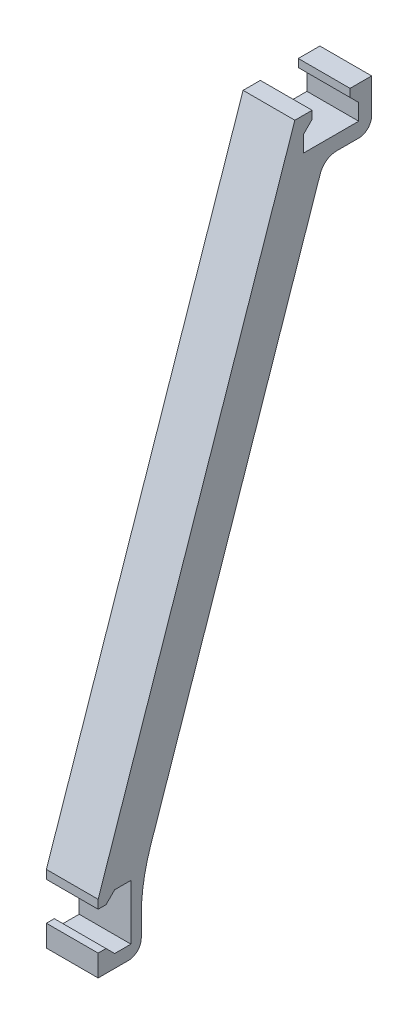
SolidWorks part; units mm, degrees
ref_plane "Plano frontal" through (0, 0, 0) normal (1, 0, 0) x (0, 1, 0)
ref_plane "Plano superior" through (0, 0, 0) normal (0, 0, 1) x (0, 1, 0)
ref_plane "Plano direito" through (0, 0, 0) normal (0, 1, 0) x (-1, 0, 0)
sketch "Esboço1" plane through (0, 0, 0) normal (1, 0, 0) x (0, 1, 0)
  line L14 (-77.8, -10) -> (-77.8, -10.9172)
  line L15 (-77.8, -10.9172) -> (-76.8, -11.9172)
  line L16 (-76.8, -11.9172) -> (-76.8, -13.8)
  line L17 (-76.8, -13.8) -> (-83.2, -13.8)
  line L18 (-83.2, -13.8) -> (-83.2, -11.9172)
  line L19 (-83.2, -11.9172) -> (-82.2, -10.9172)
  line L20 (-82.2, -10.9172) -> (-82.2, -10)
  line L21 (-77.8, -10) -> (-77.8, -10.9172)
  line L22 (-77.8, -10.9172) -> (-76.8, -11.9172)
  line L23 (-76.8, -11.9172) -> (-76.8, -13.8)
  line L24 (-76.8, -13.8) -> (-83.2, -13.8)
  line L25 (-83.2, -13.8) -> (-83.2, -11.9172)
  line L26 (-83.2, -11.9172) -> (-82.2, -10.9172)
  line L27 (-82.2, -10.9172) -> (-82.2, -10)
  line L28 (-10, -34.8) -> (-10, -32.8)
  line L29 (-10, -29) -> (-10, -35) construction
  line L30 (-10, -32.8) -> (-76.8, -10)
  line L31 (-78, -10) -> (-10, -10) construction
  line L32 (-76.8, -10) -> (-77.8, -10)
  line L33 (-82.2, -10) -> (-84.7, -10)
  line L34 (-156, -10) -> (-82, -10) construction
  line L35 (-10, -39.2) -> (-10.9172, -39.2)
  line L36 (-10.9172, -39.2) -> (-11.9172, -40.2)
  line L37 (-11.9172, -40.2) -> (-13.8, -40.2)
  line L38 (-13.8, -40.2) -> (-13.8, -33.8)
  line L39 (-13.8, -33.8) -> (-11.9172, -33.8)
  line L40 (-11.9172, -33.8) -> (-10.9172, -34.8)
  line L41 (-10.9172, -34.8) -> (-10, -34.8)
  line L42 (-10, -39.2) -> (-10.9172, -39.2)
  line L43 (-10.9172, -39.2) -> (-11.9172, -40.2)
  line L44 (-11.9172, -40.2) -> (-13.8, -40.2)
  line L45 (-13.8, -40.2) -> (-13.8, -33.8)
  line L46 (-13.8, -33.8) -> (-11.9172, -33.8)
  line L47 (-11.9172, -33.8) -> (-10.9172, -34.8)
  line L48 (-10.9172, -34.8) -> (-10, -34.8)
  line L49 (-84.7, -10) -> (-84.7, -15)
  line L50 (-84.7, -15) -> (-77.6298, -15)
  line L51 (-77.6298, -15) -> (-15.5, -36.206)
  line L52 (-15.5, -36.206) -> (-15.5, -41.7)
  line L53 (-15.5, -41.7) -> (-10, -41.7)
  line L54 (-10, -39) -> (-10, -46) construction
  line L55 (-10, -41.7) -> (-10, -39.2)
  point P23 (-10, -42.2001)
  point P33 (-10, -31.3629)
  point P34 (-10, -32.4805)
  point P35 (-15.9174, -37.425)
  point P36 (-15.9174, -41.7)
  point P37 (-15.9174, -37.2218)
  dimension "D3" = 2
  dimension "D4" = 1.5
  dimension "D5" = 5.5
  dimension "D6" = 5
  dimension "D7" = 1.5
  dimension "D8" = 5
  dimension "D9" = 1
  dimension "D1" = 0.2
  dimension "D2" = 0.2
extrude "Ressalto-extrusão1" add sketch "Esboço1" along normal blind 6
fillet "Filete1" radius 1.5 2 edges at (3, -15.5, -41.7) (3, -84.7, -15)
fillet "Filete3" radius 20 1 edges at (3, -77.6298, -15)
fillet "Filete4" radius 2 1 edges at (3, -15.5, -36.206)
